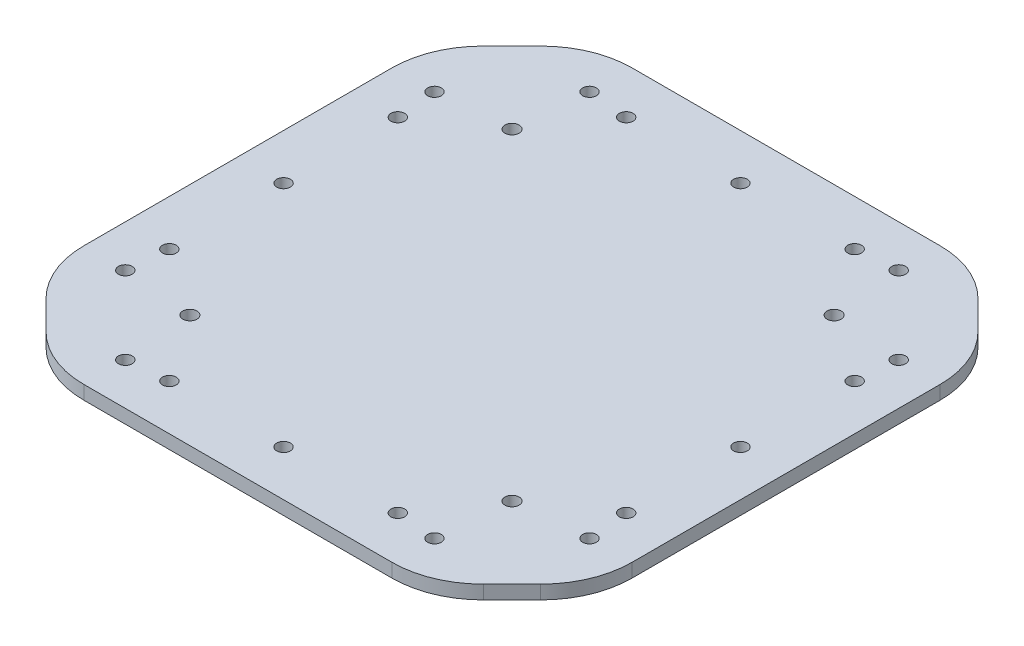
SolidWorks part; units mm, degrees
ref_plane "前视基准面" through (0, 0, 0) normal (0, 0, 1) x (1, 0, 0)
ref_plane "上视基准面" through (0, 0, 0) normal (0, 1, 0) x (1, 0, 0)
ref_plane "右视基准面" through (0, 0, 0) normal (1, 0, 0) x (0, 0, -1)
other "Configuration Table"
sketch "草图1" plane through (0, 0, 0) normal (0, 1, 0) x (1, 0, 0)
  line L0 (-60, 60) -> (60, -60) construction
  line L1 (-60, 60) -> (60, 60)
  line L2 (-60, 60) -> (-60, -60)
  line L3 (-60, -60) -> (60, -60)
  line L4 (60, 60) -> (60, -60)
  line L5 (0, -60) -> (0, 60) construction
  line L6 (-60, 0) -> (60, 0) construction
  line L7 (60, 60) -> (-60, -60) construction
  line L8 (-33.837, 50.8076) -> (-50.8118, 33.8329) construction
  line L9 (-30.5438, 30.5438) -> (-27.95, 27.95) construction
  line L10 (-60, 42) -> (-42, 60)
  line L11 (42, 60) -> (60, 42)
  line L12 (60, -42) -> (42, -60)
  line L13 (-42, -60) -> (-60, -42)
  circle A0 centre (-35.2513, 35.2513) radius 1.5558
  circle A1 centre (-33.837, 50.8076) radius 1.5
  circle A2 centre (-50.8076, 33.837) radius 1.5
  circle A3 centre (33.837, 50.8076) radius 1.5
  circle A4 centre (35.2513, 35.2513) radius 1.5558
  circle A5 centre (50.8076, 33.837) radius 1.5
  circle A6 centre (50.8076, -33.837) radius 1.5
  circle A7 centre (35.2513, -35.2513) radius 1.5558
  circle A8 centre (33.837, -50.8076) radius 1.5
  circle A9 centre (-33.837, -50.8076) radius 1.5
  circle A10 centre (-35.2513, -35.2513) radius 1.5558
  circle A11 centre (-50.8076, -33.837) radius 1.5
  circle A12 centre (-50, 0) radius 1.5
  circle A14 centre (-50, -25) radius 1.5
  circle A15 centre (-50, 25) radius 1.5
  circle A16 centre (25, 50) radius 1.5
  circle A17 centre (0, 50) radius 1.5
  circle A18 centre (-25, 50) radius 1.5
  circle A19 centre (50, -25) radius 1.5
  circle A20 centre (50, 0) radius 1.5
  circle A21 centre (50, 25) radius 1.5
  circle A22 centre (-25, -50) radius 1.5
  circle A23 centre (0, -50) radius 1.5
  circle A24 centre (25, -50) radius 1.5
  point P0 (0, 0)
  point P13 (-42.3223, 42.3223)
  point P16 (0, 0)
  point P35 (0, 0)
  point P44 (-5, 5)
  point P46 (-10, 10)
  point P47 (0, 0)
  point P72 (0, 0)
  dimension "D3" = 12
  dimension "D11" = 10
  dimension "D13" = 25
  dimension "D12" = 25
  dimension "D1" = 120
  dimension "D2" = 120
  dimension "D4" = 12
  dimension "D5" = 10
  dimension "D6" = 25
  dimension "D8" = 18
  dimension "D9" = 18
  dimension "D7" = 4
  dimension "D10" = 4
  dimension "D14" = 4
extrude "凸台-拉伸1" add sketch "草图1" along normal blind 3
fillet "圆角1" radius 20 8 edges at (-42, 1.5, 60) (-60, 1.5, 42) (42, 1.5, 60) (60, 1.5, 42) (42, 1.5, -60) (60, 1.5, -42) (-42, 1.5, -60) (-60, 1.5, -42)
